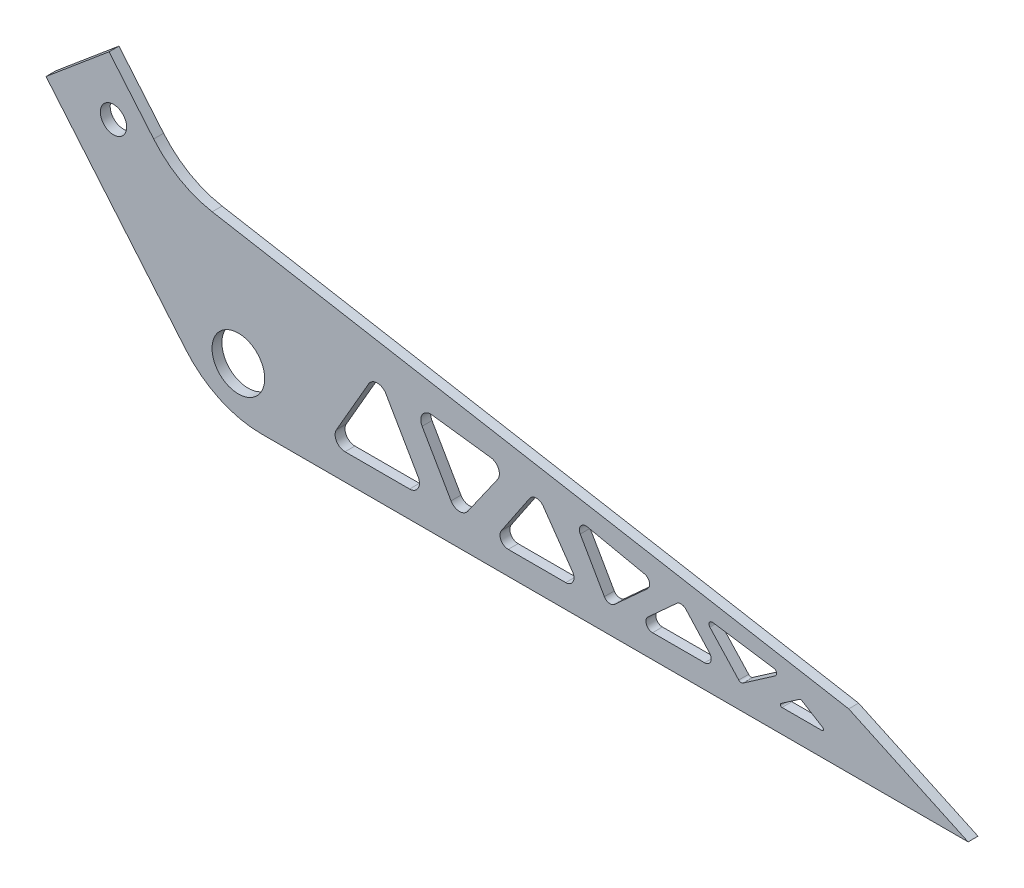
SolidWorks part; units mm, degrees
ref_plane "Front Plane" through (0, 0, 0) normal (0, 0, 1) x (1, 0, 0)
ref_plane "Top Plane" through (0, 0, 0) normal (0, 1, 0) x (1, 0, 0)
ref_plane "Right Plane" through (0, 0, 0) normal (1, 0, 0) x (0, 0, -1)
sketch "Sketch1" plane through (0, 0, 0) normal (0, 0, 1) x (1, 0, 0)
  line L0 (0, 0) -> (19.1511, 16.0697)
  line L1 (19.1511, 16.0697) -> (32.7016, -0.0792)
  line L2 (50.4735, -10.3398) -> (243.7516, -44.4199)
  line L3 (0, 0) -> (42.4309, -50.5672)
  line L4 (243.7516, -44.4199) -> (280.023, -61.2836)
  line L5 (65.4122, -61.2836) -> (280.023, -61.2836)
  line L7 (11.4907, 9.6418) -> (20.4897, -1.0828) construction
  line L9 (20.4897, -1.0828) -> (28.1501, 5.3451) construction
  line L10 (20.4897, -1.0828) -> (61.4717, -49.9233) construction
  line L11 (20.4897, -1.0828) -> (25.9611, -1.0828) construction
  line L12 (26.4894, -5.0744) -> (131.6515, -133.5602) construction
  line L13 (23.0608, -4.147) -> (53.2719, -40.1511)
  line L14 (19.1511, 16.0697) -> (28.3877, 16.0697)
  line L25 (90.8014, -53.2836) -> (110.4091, -53.2836)
  line L26 (113.0071, -48.7836) -> (103.2033, -31.8028)
  line L27 (98.0071, -31.8028) -> (88.2033, -48.7836)
  line L29 (114.2167, -34.8786) -> (123.0068, -50.1034)
  line L30 (128.0612, -50.3258) -> (137.143, -37.3737)
  line L31 (135.0651, -32.6754) -> (117.1932, -30.4026)
  line L32 (140.3627, -54.1786) -> (157.8257, -54.1786)
  line L33 (159.877, -50.2497) -> (150.9921, -37.4946)
  line L34 (146.8662, -37.5284) -> (138.2882, -50.2835)
  line L36 (162.2271, -39.2083) -> (169.563, -52.0161)
  line L37 (172.6447, -52.5011) -> (182.6743, -43.3725)
  line L38 (181.7426, -39.9368) -> (164.3771, -36.2577)
  line L39 (184.1894, -54.1786) -> (200.0071, -54.1786)
  line L40 (201.4862, -50.8324) -> (194.3195, -42.9584)
  line L41 (191.4942, -42.8256) -> (182.8432, -50.6996)
  line L42 (210.3711, -53.5393) -> (201.5935, -44.0226)
  line L43 (202.4755, -42.3555) -> (221.0139, -45.1091)
  line L44 (221.4365, -46.9202) -> (211.6758, -53.6833)
  line L45 (223.2272, -53.2677) -> (228.8914, -49.343)
  line L46 (229.4371, -49.3275) -> (235.852, -53.2521)
  line L47 (235.5911, -54.1786) -> (223.512, -54.1786)
  arc A0 (65.4122, -61.2836) -> (42.4309, -50.5672) centre (65.4122, -31.2836) cw
  arc A1 (50.4735, -10.3398) -> (32.7016, -0.0792) centre (55.683, 19.2044) cw
  circle A2 centre (20.4897, -1.0828) radius 4
  circle A3 centre (58.4142, -46.2794) radius 8
  arc A4 (110.4091, -53.2836) -> (113.0071, -48.7836) centre (110.4091, -50.2836) ccw
  arc A5 (90.8014, -53.2836) -> (88.2033, -48.7836) centre (90.8014, -50.2836) cw
  arc A6 (98.0071, -31.8028) -> (103.2033, -31.8028) centre (100.6052, -33.3028) cw
  arc A7 (123.0068, -50.1034) -> (128.0612, -50.3258) centre (125.6048, -48.6034) ccw
  arc A8 (137.143, -37.3737) -> (135.0651, -32.6754) centre (134.6866, -35.6514) ccw
  arc A9 (114.2167, -34.8786) -> (117.1932, -30.4026) centre (116.8148, -33.3786) cw
  arc A10 (157.8257, -54.1786) -> (159.877, -50.2497) centre (157.8257, -51.6786) ccw
  arc A11 (138.2882, -50.2835) -> (140.3627, -54.1786) centre (140.3627, -51.6786) ccw
  arc A12 (146.8662, -37.5284) -> (150.9921, -37.4946) centre (148.9407, -38.9235) cw
  arc A13 (182.6743, -43.3725) -> (181.7426, -39.9368) centre (181.3281, -41.8934) ccw
  arc A14 (172.6447, -52.5011) -> (169.563, -52.0161) centre (171.2985, -51.0221) cw
  arc A15 (162.2271, -39.2083) -> (164.3771, -36.2577) centre (163.9626, -38.2143) cw
  arc A16 (184.1894, -54.1786) -> (182.8432, -50.6996) centre (184.1894, -52.1786) cw
  arc A17 (200.0071, -54.1786) -> (201.4862, -50.8324) centre (200.0071, -52.1786) ccw
  arc A18 (194.3195, -42.9584) -> (191.4942, -42.8256) centre (192.8404, -44.3047) ccw
  arc A19 (221.4365, -46.9202) -> (221.0139, -45.1091) centre (220.8669, -46.0982) ccw
  arc A20 (210.3711, -53.5393) -> (211.6758, -53.6833) centre (211.1062, -52.8613) ccw
  arc A21 (201.5935, -44.0226) -> (202.4755, -42.3555) centre (202.3286, -43.3446) cw
  arc A22 (223.512, -54.1786) -> (223.2272, -53.2677) centre (223.512, -53.6786) cw
  arc A23 (235.5911, -54.1786) -> (235.852, -53.2521) centre (235.5911, -53.6786) ccw
  arc A24 (229.4371, -49.3275) -> (228.8914, -49.343) centre (229.1761, -49.754) ccw
  point P12 (51.423, -61.2836)
  point P15 (39.7203, -8.4437)
  point P55 (100.6052, -27.3028)
  point P58 (125.3596, -54.1786)
  point P73 (170.8017, -54.1786)
  dimension "D9" = 30
  dimension "D12" = 50
  dimension "D14" = 16
  dimension "D16" = 8
  dimension "D20" = 3
  dimension "D21" = 3
  dimension "D22" = 2.5
  dimension "D23" = 2
  dimension "D24" = 2
  dimension "D25" = 1
  dimension "D26" = 0.5
  dimension "D1" = 25
  dimension "D2" = 32
  dimension "D3" = 40
  dimension "D4" = 80
  dimension "D5" = 228.6
  dimension "D6" = 50
  dimension "D7" = 140
  dimension "D8" = 207.1787
  dimension "D10" = 10
  dimension "D11" = 10
  dimension "D13" = 47
  dimension "D15" = 14
  dimension "D17" = 8
  dimension "D18" = 8
  dimension "D19" = 8
extrude "Boss-Extrude1" add sketch "Sketch1" along normal blind 3
